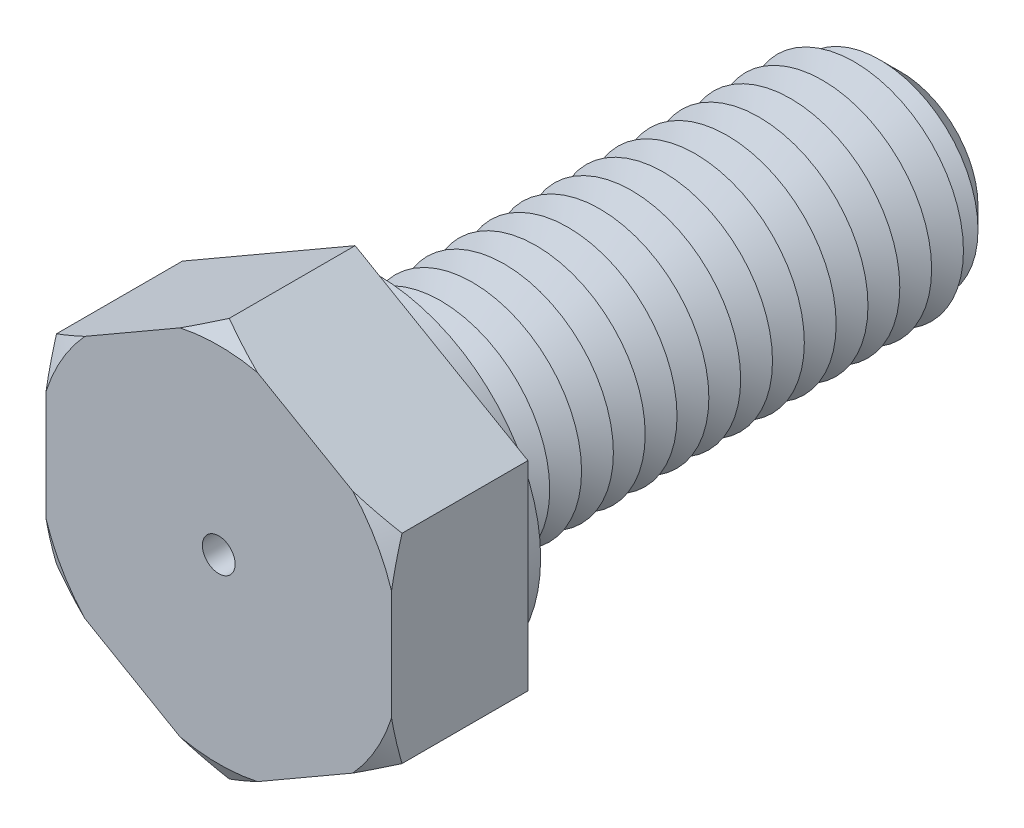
SolidWorks part; units mm, degrees
ref_plane "Front Plane" through (0, 0, 0) normal (0, 0, 1) x (1, 0, 0)
ref_plane "Top Plane" through (0, 0, 0) normal (0, 1, 0) x (1, 0, 0)
ref_plane "Right Plane" through (0, 0, 0) normal (1, 0, 0) x (0, 0, -1)
sketch "Sketch2" plane through (0, 0, 0) normal (0, 0, 1) x (1, 0, 0)
  line L1 (0, 10.9697) -> (-9.5, 5.4848)
  line L2 (-9.5, 5.4848) -> (-9.5, -5.4848)
  line L3 (-9.5, -5.4848) -> (0, -10.9697)
  line L4 (0, -10.9697) -> (9.5, -5.4848)
  line L5 (9.5, -5.4848) -> (9.5, 5.4848)
  line L6 (9.5, 5.4848) -> (0, 10.9697)
  circle A0 centre (0, 0) radius 9.5 construction
  dimension "D1" = 19
extrude "Boss-Extrude1" add sketch "Sketch2" along normal blind 7.5
sketch "Sketch3" plane through (0, 0, 0) normal (0, 0, -1) x (-1, 0, 0)
  circle A0 centre (0, 0) radius 6
  dimension "D1" = 12
extrude "Boss-Extrude2" add sketch "Sketch3" along normal blind 30
sketch "Sketch4" plane through (0, 0, 0) normal (0, 0, -1) x (-1, 0, 0)
  circle A0 centre (0, 0) radius 9
  dimension "D1" = 18
extrude "Boss-Extrude3" add sketch "Sketch4" along normal blind 1.2
sketch "Sketch5" plane through (0, 0, 0) normal (1, 0, 0) x (0, 0, -1)
  line L0 (-3.2117, 0) -> (6.3192, 0) construction
chamfer "Chamfer1" distance 1.75 angle 45 1 edges at (-6, 0, -30)
sketch "Sketch6" plane through (0, 0, 0) normal (1, 0, 0) x (0, 0, -1)
  line L0 (1.2, 6) -> (2.075, 4.4845)
  line L1 (2.075, 4.4845) -> (2.95, 6)
  line L2 (28.25, 6) -> (1.2, 6) construction
  line L3 (2.95, 6) -> (1.2, 6)
  dimension "D1" = 1.75
revolve "Cut-Revolve1" cut sketch "Sketch6" angle 360 about L0
pattern_linear "LPattern1" count 16 spacing 1.75 along (0, 0, -1) of "Cut-Revolve1"
sketch "Sketch7" plane through (0, 0, 0) normal (1, 0, 0) x (0, 0, -1)
  line L0 (-7.5, 10.9697) -> (-7.5, 9.9697)
  line L1 (-7.5, 5.4848) -> (-7.5, 10.9697) construction
  line L2 (-7.5, 9.9697) -> (-6.9226, 10.9697)
  line L3 (-7.5, 10.9697) -> (0, 10.9697) construction
  line L4 (-6.9226, 10.9697) -> (-7.5, 10.9697)
  dimension "D1" = 1
  dimension "D2" = 30
revolve "Cut-Revolve2" cut sketch "Sketch7" angle 360 about L0
sketch "Sketch8" plane through (0, 0, 7.5) normal (0, 0, 1) x (1, 0, 0)
  circle A0 centre (0, 0) radius 0.9
  dimension "D1" = 1.8
extrude "Cut-Extrude1" cut sketch "Sketch8" against normal up to surface (37.5 mm away)
